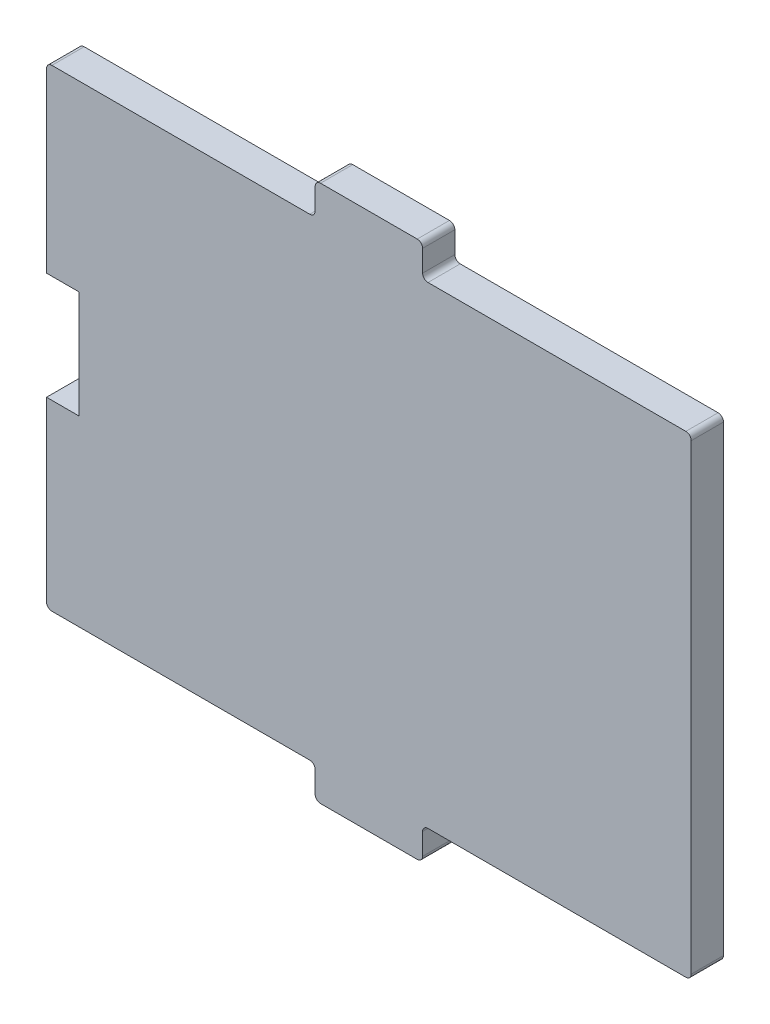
SolidWorks part; units mm, degrees
ref_plane "Front Plane" through (0, 0, 0) normal (0, 0, 1) x (1, 0, 0)
ref_plane "Top Plane" through (0, 0, 0) normal (0, 1, 0) x (1, 0, 0)
ref_plane "Right Plane" through (0, 0, 0) normal (1, 0, 0) x (0, 0, -1)
sketch "Sketch1" plane through (0, 0, 0) normal (0, 0, 1) x (1, 0, 0)
  line L0 (-10, 0) -> (10, 0)
  line L1 (10, 0) -> (10, 6)
  line L2 (10, 6) -> (60, 6)
  line L3 (60, 6) -> (60, 94)
  line L4 (60, 94) -> (10, 94)
  line L5 (10, 94) -> (10, 100)
  line L6 (10, 100) -> (-10, 100)
  line L7 (0, 0) -> (0, 100) construction
  line L8 (-10, 94) -> (-10, 100)
  line L9 (-60, 94) -> (-10, 94)
  line L10 (-60, 6) -> (-60, 94)
  line L11 (-10, 0) -> (-10, 6)
  line L12 (-10, 6) -> (-60, 6)
  point P4 (0, 0)
  dimension "D1" = 20
  dimension "D2" = 6
  dimension "D3" = 60
  dimension "D4" = 100
extrude "Boss-Extrude1" add sketch "Sketch1" along normal blind 6
fillet "Fillet1" radius 1 12 edges at (-10, 0, 3) (-10, 6, 3) (10, 0, 3) (60, 6, 3) (10, 6, 3) (60, 94, 3) (-60, 6, 3) (-60, 94, 3) (-10, 100, 3) (-10, 94, 3) (10, 100, 3) (10, 94, 3)
sketch "Sketch2" plane through (0, 0, 0) normal (0, 0, -1) x (-1, 0, 0)
  line L0 (60, 93) -> (60, 7) construction
  line L1 (60, 60) -> (54, 60)
  line L2 (60, 60) -> (60, 40)
  line L3 (60, 40) -> (54, 40)
  line L4 (54, 60) -> (54, 40)
  line L5 (60, 93) -> (60, 7) construction
  point P6 (60, 50)
  point P7 (60, 50)
  dimension "D1" = 6
  dimension "D2" = 20
extrude "Cut-Extrude1" cut sketch "Sketch2" against normal through all
